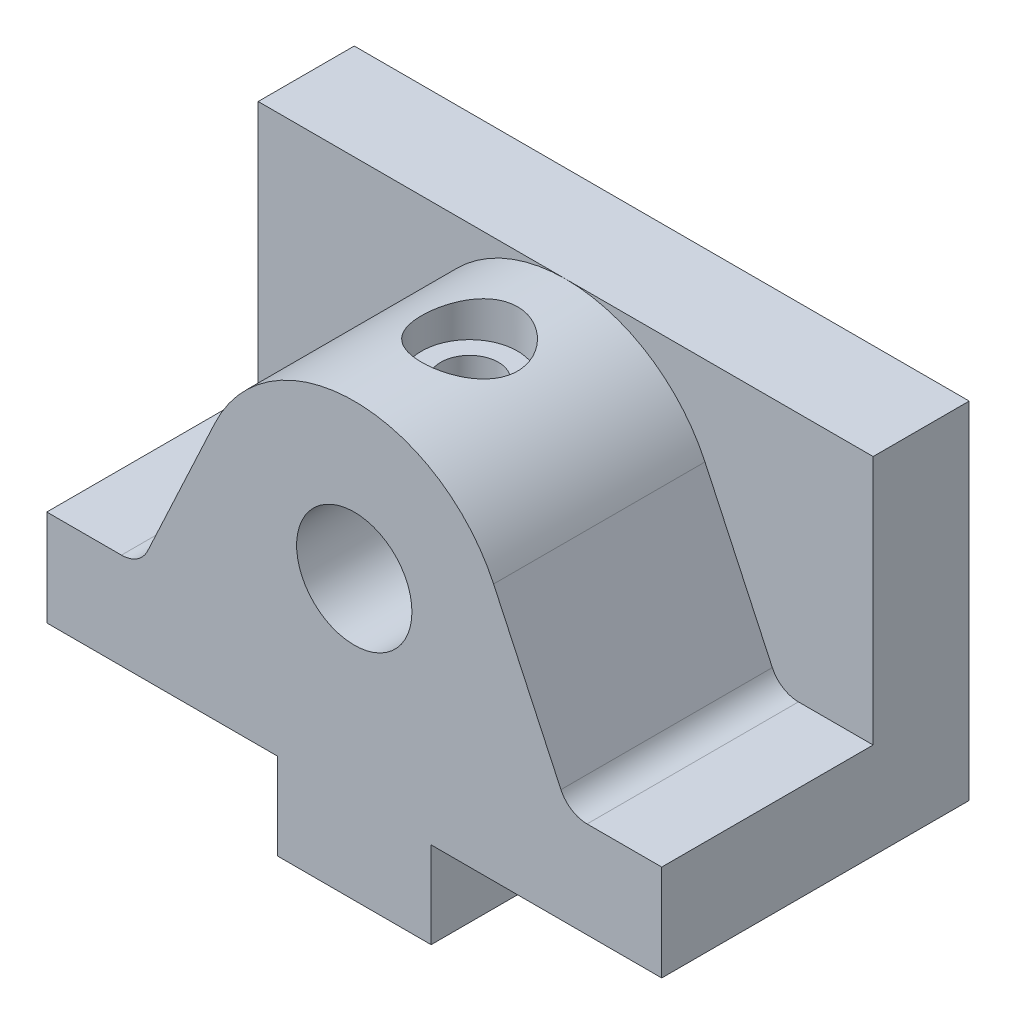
SolidWorks part; units mm, degrees
ref_plane "Front Plane" through (0, 0, 0) normal (0, 0, 1) x (1, 0, 0)
ref_plane "Top Plane" through (0, 0, 0) normal (0, 1, 0) x (1, 0, 0)
ref_plane "Right Plane" through (0, 0, 0) normal (1, 0, 0) x (0, 0, -1)
sketch "Sketch2" plane through (0, 0, 0) normal (1, 0, 0) x (0, 0, -1)
  line L0 (-32, 0) -> (0, 0)
  line L1 (0, 0) -> (0, 36)
  line L2 (0, 36) -> (-10, 36)
  line L3 (-10, 36) -> (-10, 10)
  line L4 (-10, 10) -> (-32, 10)
  line L5 (-32, 10) -> (-32, 0)
  dimension "D1" = 32
  dimension "D2" = 36
  dimension "D3" = 10
  dimension "D4" = 10
extrude "Boss-Extrude1" add sketch "Sketch2" along normal mid plane 64
sketch "Sketch3" plane through (0, 0, 32) normal (0, 0, 1) x (1, 0, 0)
  line L0 (-22.3171, 10) -> (-14.5009, 26.7619)
  line L1 (32, 10) -> (-32, 10) construction
  line L3 (14.5009, 26.7619) -> (22.3171, 10)
  line L4 (32, 10) -> (-32, 10) construction
  line L5 (22.3171, 10) -> (-22.3171, 10)
  line L6 (0, 0) -> (0, -12.149) construction
  line L7 (32, 36) -> (-32, 36) construction
  arc A0 (-14.5009, 26.7619) -> (14.5009, 26.7619) centre (0, 20) cw
  dimension "D1" = 16
  dimension "D2" = 50
extrude "Boss-Extrude2" add sketch "Sketch3" against normal up to next
sketch "Sketch4" plane through (0, 0, 32) normal (0, 0, 1) x (1, 0, 0)
  line L0 (32, 0) -> (-32, 0) construction
  line L1 (-8, -9) -> (8, -9)
  line L2 (-8, -9) -> (-8, 0)
  line L3 (-8, 0) -> (8, 0)
  line L4 (8, -9) -> (8, 0)
  line L5 (-8, -9) -> (8, 0) construction
  line L6 (-8, 0) -> (8, -9) construction
  point P0 (0, -4.5)
  dimension "D1" = 16
  dimension "D2" = 9
extrude "Boss-Extrude3" add sketch "Sketch4" against normal through all
fillet "Fillet1" radius 3 2 edges at (-22.3171, 10, 21) (22.3171, 10, 21)
sketch "Sketch5" plane through (0, 0, 32) normal (0, 0, 1) x (1, 0, 0)
  circle A0 centre (0, 20) radius 6
  arc A1 (14.5009, 26.7619) -> (-14.5009, 26.7619) centre (0, 20) ccw construction
  dimension "D1" = 12
extrude "Cut-Extrude1" cut sketch "Sketch5" against normal blind 24
ref_plane "Plane1" through (0, 36, 32) normal (0, 1, 0) x (-1, 0, 0)
hole_wizard "CBORE for M10 Hex Head Bolt1" positions "Sketch7" profile "Sketch8" counterbore size "M10" standard "ISO"
sketch "Sketch7" plane through (0, 36, 32) normal (0, 1, 0) x (-1, 0, 0)
  line L0 (14.5009, 0) -> (-14.5009, 0) construction
  line L1 (0, 0) -> (0, -12.8454) construction
  point P1 (0, -12)
  point P7 (0, 0)
  dimension "D1" = 12
sketch "Sketch8" plane through (0, 36, 20) normal (1, 0, 0) x (0, 0, 1)
  line L0 (0, 0) -> (0, 17.8016)
  line L1 (0, 17.8016) -> (3, 15.999)
  line L2 (3, 15.999) -> (3, 4)
  line L3 (3, 4) -> (5, 4)
  line L4 (5, 4) -> (5, 0)
  line L5 (5, 0) -> (0, 0)
  line L10 (0, 17.8016) -> (-3, 15.999) construction
  line L11 (0, -6.35) -> (0, 107.95) construction
  dimension "Hole Dia." = 6
  dimension "Hole Depth" = 15.999
  dimension "C'Bore Dia." = 10
  dimension "C'Bore Depth" = 4
  dimension "Drill Angle" = 118
hole_wizard "Ø6.0 (6) Diameter Hole1" positions "Sketch10" profile "Sketch9" hole size "Ø6.0" standard "Ansi Metric"
sketch "Sketch10" plane through (0, -9, 0) normal (0, -1, 0) x (1, 0, 0)
  line L0 (-8, 32) -> (8, 32) construction
  point P0 (0, 24)
  point P1 (0, 8)
  dimension "D1" = 8
  dimension "D2" = 16
sketch "Sketch9" plane through (0, -9, 24) normal (1, 0, 0) x (0, 0, -1)
  line L0 (0, 0) -> (0, 17.8026)
  line L1 (0, 17.8026) -> (3, 16)
  line L2 (3, 16) -> (3, 0)
  line L5 (3, 0) -> (0, 0)
  line L10 (0, 17.8026) -> (-3, 16) construction
  line L11 (0, -6.35) -> (0, 107.95) construction
  dimension "Hole Dia." = 6
  dimension "Hole Depth" = 16
  dimension "Drill Angle" = 118
